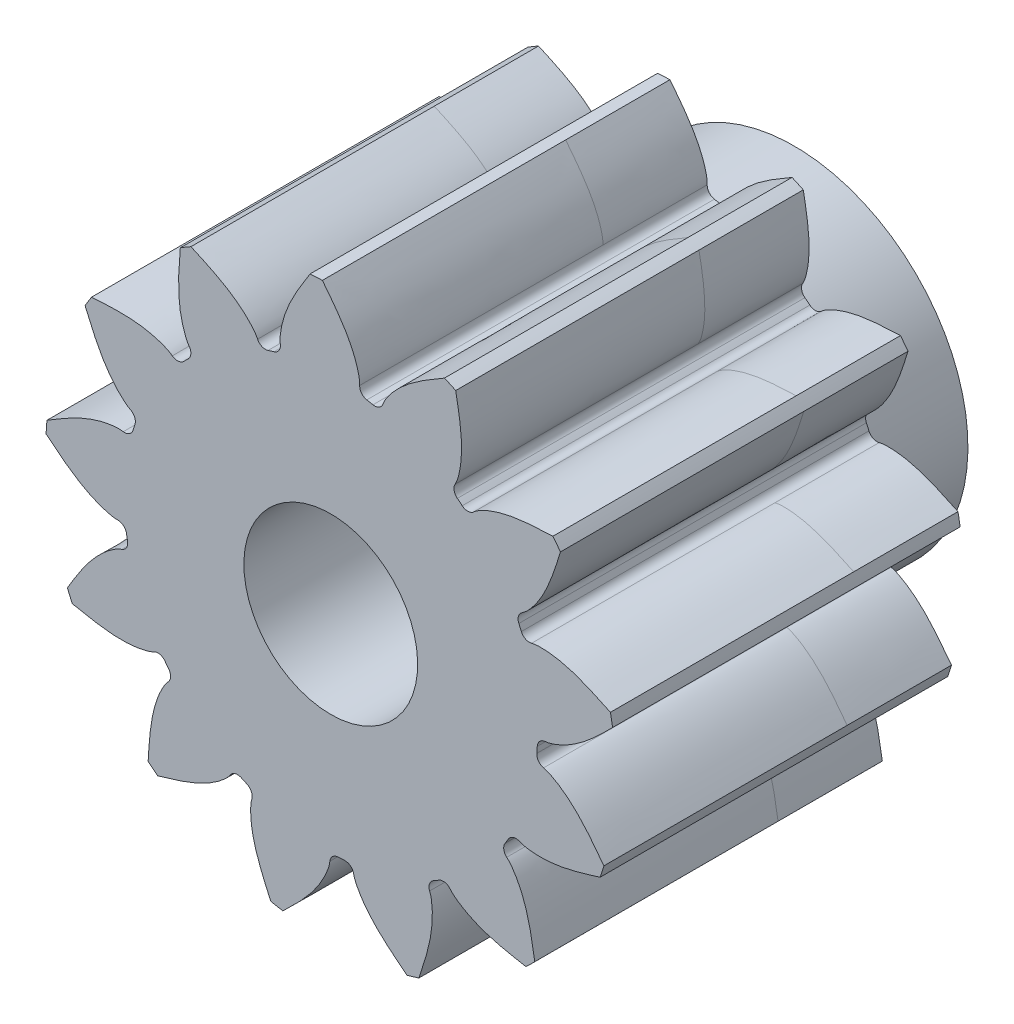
SolidWorks part; units mm, degrees
ref_plane "Face" through (0, 0, 0) normal (0, 0, 1) x (1, 0, 0)
ref_plane "Dessus" through (0, 0, 0) normal (0, 1, 0) x (1, 0, 0)
ref_plane "Droite" through (0, 0, 0) normal (1, 0, 0) x (0, 0, -1)
imported_body "Importée1"
sketch "Esquisse1" plane through (0, 0, 2.1) normal (0, 0, 1) x (1, 0, 0)
  circle A0 centre (0, 0) radius 1.991
  dimension "D1" = 3.982
surface "Surface-primitive" sketch "Esquisse1"
